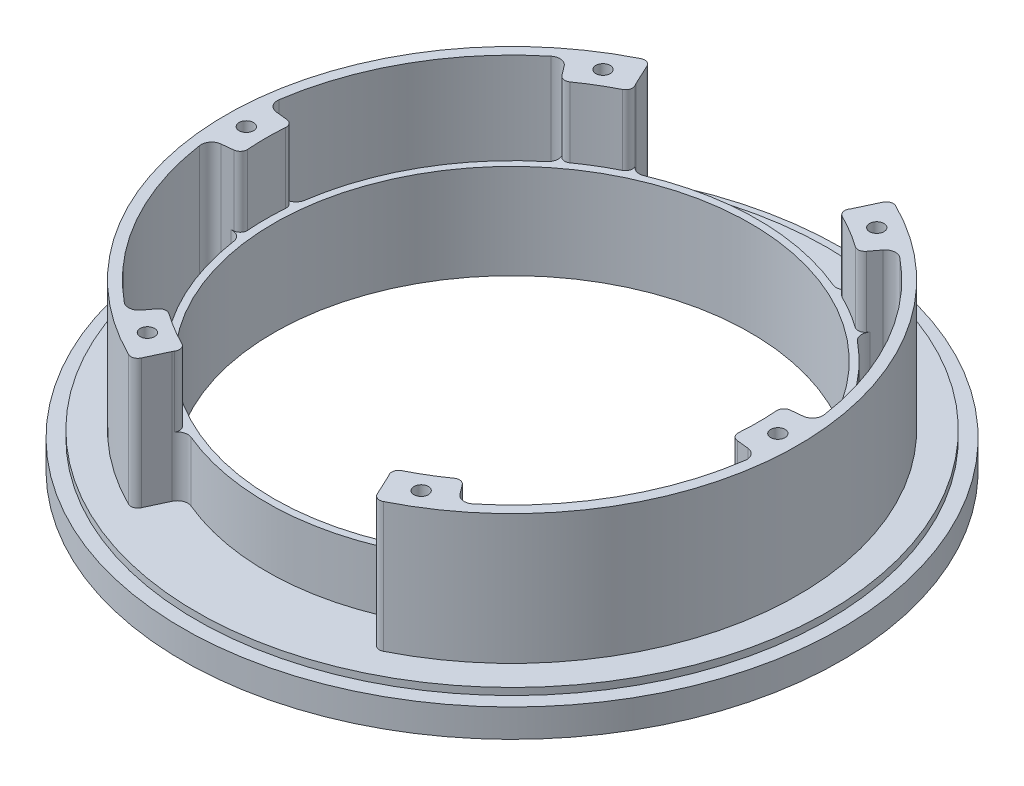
SolidWorks part; units mm, degrees
ref_plane "前视基准面" through (0, 0, 0) normal (0, 0, 1) x (1, 0, 0)
ref_plane "上视基准面" through (0, 0, 0) normal (0, 1, 0) x (1, 0, 0)
ref_plane "右视基准面" through (0, 0, 0) normal (1, 0, 0) x (0, 0, -1)
sketch "草图1" plane through (0, 0, 0) normal (0, 1, 0) x (1, 0, 0)
  circle A0 centre (0, 0) radius 34
  circle A1 centre (0, 0) radius 35
  dimension "D1" = 68
  dimension "D2" = 1
extrude "凸台-拉伸1" add sketch "草图1" along normal blind 23.5
sketch "草图2" plane through (0, 0, 0) normal (0, -1, 0) x (1, 0, 0)
  circle A0 centre (0, 0) radius 45
  circle A1 centre (0, 0) radius 35 construction
  circle A2 centre (0, 0) radius 35
  dimension "D1" = 90
extrude "凸台-拉伸2" add sketch "草图2" against normal blind 5
sketch "草图4" plane through (0, 5, 0) normal (0, 1, 0) x (1, 0, 0)
  circle A0 centre (0, 0) radius 40.8
  circle A1 centre (0, 0) radius 35 construction
  circle A2 centre (0, 0) radius 35
  dimension "D1" = 81.6
extrude "凸台-拉伸3" add sketch "草图4" along normal up to surface (18.5 mm away)
sketch "草图5" plane through (0, 23.5, 0) normal (0, 1, 0) x (1, 0, 0)
  line L0 (0, 59.1249) -> (0, -53.9469) construction
  line L1 (-57.4727, 0) -> (56.5953, 0) construction
  line L2 (0, 0) -> (-17.2428, 36.9774)
  line L3 (0, 0) -> (17.2428, 36.9774)
  line L4 (0, 0) -> (17.2428, -36.9774)
  line L5 (0, 0) -> (-17.2428, -36.9774)
  circle A0 centre (0, 0) radius 40.8 construction
  circle A1 centre (0, 0) radius 40.8 construction
  circle A2 centre (0, 0) radius 40.8
  circle A3 centre (0, 0) radius 35
  circle A4 centre (0, 0) radius 34 construction
  dimension "D2" = 1
  dimension "D1" = 25
extrude "切除-拉伸1" cut sketch "草图5" against normal up to surface (18.5 mm away) contours A3 L3 L2 M6 | A3 L5 L4 M6
sketch "草图6" plane through (0, 0, 0) normal (0, -1, 0) x (1, 0, 0)
  circle A0 centre (0, 0) radius 47
  circle A1 centre (0, 0) radius 45
  circle A2 centre (0, 0) radius 45
  dimension "D2" = 2
  dimension "D1" = 0
extrude "凸台-拉伸4" add sketch "草图6" against normal offset from surface (4 mm away) 1
sketch "草图8" plane through (0, 0, 0) normal (0, -1, 0) x (1, 0, 0)
  circle A0 centre (-10.0813, -37.624) radius 1.5
  circle A1 centre (-5.7574, -38.5233) radius 1.5
  circle A2 centre (-2.3914, -39.0995) radius 1
  circle A3 centre (0.3418, -39.1711) radius 1
  circle A4 centre (3.0734, -39.0518) radius 1
  circle A5 centre (5.7901, -38.7423) radius 1
  circle A6 centre (8.4785, -38.244) radius 1
  circle A7 centre (7.9374, -35.8033) radius 1
  circle A8 centre (5.4205, -36.2697) radius 1
  circle A9 centre (2.8773, -36.5595) radius 1
  circle A10 centre (0.32, -36.6712) radius 1
  circle A11 centre (-2.2388, -36.6042) radius 1
  dimension "D1" = 3
extrude "切除-拉伸3" cut sketch "草图8" against normal through all
sketch "草图9" plane through (0, 23.5, 0) normal (0, 1, 0) x (1, 0, 0)
  circle A0 centre (0, 0) radius 35
extrude "切除-拉伸4" cut sketch "草图9" against normal blind 10
sketch "草图10" plane through (0, 23.5, 0) normal (0, 1, 0) x (1, 0, 0)
  line L0 (0, 0) -> (0, 58.5736) construction
  line L1 (0, 0) -> (-16.0172, 34.3491) construction
  line L2 (-14.7916, 31.7208) -> (-17.2428, 36.9774) construction
  line L3 (-19.5199, 32.4866) -> (0, 0) construction
  line L4 (0, 0) -> (-37.9, 0) construction
  circle A0 centre (0, 0) radius 37.9 construction
  arc A1 (-14.7916, 31.7208) -> (-14.7916, -31.7208) centre (0, 0) ccw construction
  circle A2 centre (-19.5199, 32.4866) radius 1.25
  circle A3 centre (-37.9, 0) radius 1.766
  circle A4 centre (-19.5199, -32.4866) radius 1.25
  circle A5 centre (19.5199, -32.4866) radius 1.25
  circle A6 centre (37.9, 0) radius 1.766
  circle A7 centre (19.5199, 32.4866) radius 1.25
  dimension "D1" = 2.9
  dimension "D2" = 2.5
  dimension "D3" = 6
hole_wizard "M2.5 螺纹孔1" positions "3D草图1" profile "草图12" tap size "M2.5" standard "GB"
sketch3d "3D草图1"
  point P0 (-19.5199, 23.5, -32.4866)
  point P4 (-37.9, 23.5, 0)
  point P7 (19.5199, 23.5, -32.4866)
  point P10 (37.9, 23.5, 0)
  point P13 (19.5199, 23.5, 32.4866)
  point P16 (-19.5199, 23.5, 32.4866)
sketch "草图12" plane through (-19.5199, 23.5, -32.4866) normal (1, 0, 0) x (0, 0, 1)
  line L0 (0, 0) -> (0, 23.5)
  line L1 (0, 23.5) -> (1.025, 23.5)
  line L2 (1.025, 23.5) -> (1.025, 0)
  line L5 (1.025, 0) -> (0, 0)
  line L11 (0, -6.35) -> (0, 107.95) construction
  dimension "通孔螺纹孔钻头直径" = 2.05
  dimension "通孔螺纹孔钻头深度" = 23.5
sketch "草图13" plane through (0, 23.5, 0) normal (0, 1, 0) x (1, 0, 0)
  line L0 (-23.6513, 31.3864) -> (0, 0)
  line L1 (-19.5199, 32.4866) -> (0, 0) construction
  line L2 (0, 0) -> (-56.9776, 0) construction
  line L3 (0, 0) -> (-39.0847, 4.108)
  line L4 (0, 0) -> (-39.0847, -4.108)
  line L5 (-23.6513, -31.3864) -> (0, 0)
  line L6 (0, 0) -> (0, 27.588) construction
  line L7 (23.6513, -31.3864) -> (0, 0)
  line L8 (0, 0) -> (39.0847, -4.108)
  line L9 (0, 0) -> (39.0847, 4.108)
  line L10 (23.6513, 31.3864) -> (0, 0)
  circle A0 centre (0, 0) radius 39.3
  arc A1 (-17.2428, 36.9774) -> (-17.2428, -36.9774) centre (0, 0) ccw construction
  arc A2 (14.7916, -31.7208) -> (14.7916, 31.7208) centre (0, 0) ccw construction
  arc A3 (-14.7916, 31.7208) -> (-14.7916, -31.7208) centre (0, 0) ccw construction
  arc A4 (14.7916, -31.7208) -> (14.7916, 31.7208) centre (0, 0) ccw
  arc A5 (-14.7916, 31.7208) -> (-14.7916, -31.7208) centre (0, 0) ccw
  dimension "D1" = 1.5
  dimension "D2" = 6
  dimension "D3" = 6
extrude "切除-拉伸5" cut sketch "草图13" against normal up to surface (19.5 mm away) contours L0 A0 L3 M12 | L4 A0 L5 M12 | A4 L7 A0 L8 | A4 L9 A0 L10
fillet "圆角1" radius 1.5 16 edges at (21.0635, 8.75, 27.9522) (34.8083, 8.75, 3.6585) (23.6513, 13.75, 31.3864) (39.0847, 13.75, 4.108) (34.8083, 8.75, -3.6585) (21.0635, 8.75, -27.9522) (39.0847, 13.75, -4.108) (23.6513, 13.75, -31.3864) (-34.8083, 8.75, 3.6585) (-21.0635, 8.75, 27.9522) (-23.6513, 13.75, 31.3864) (-39.0847, 13.75, 4.108) (-21.0635, 8.75, -27.9522) (-34.8083, 8.75, -3.6585) (-39.0847, 13.75, -4.108) (-23.6513, 13.75, -31.3864)
sketch "草图14" plane through (0, 23.5, 0) normal (0, 1, 0) x (1, 0, 0)
  circle A0 centre (0, 0) radius 35.1
  arc A1 (-14.7916, 31.7208) -> (-21.0635, 27.9522) centre (0, 0) ccw construction
  dimension "D1" = 0.1
extrude "切除-拉伸6" cut sketch "草图14" against normal up to surface (10 mm away)
fillet "圆角2" radius 1 4 edges at (17.2428, 14.25, 36.9774) (-17.2428, 14.25, 36.9774) (17.2428, 14.25, -36.9774) (-17.2428, 14.25, -36.9774)
fillet "圆角5" radius 1.5 4 edges at (-14.7916, 9.25, 31.7208) (14.7916, 9.25, 31.7208) (-14.7916, 9.25, -31.7208) (14.7916, 9.25, -31.7208)
fillet "圆角6" radius 1 7 edges at (21.1237, 18.5, 28.0321) (34.9077, 18.5, 3.6689) (34.9077, 18.5, -3.6689) (21.1237, 18.5, -28.0321) (13.9999, 18.5, -32.1872) (13.9999, 18.5, 32.1872) (-13.9999, 18.5, 32.1872)
fillet "圆角7" radius 1 1 edges at (-13.9999, 18.5, -32.1872)
fillet "圆角8" radius 1 3 edges at (-34.9077, 18.5, 3.6689) (-34.9077, 18.5, -3.6689) (-21.1237, 18.5, 28.0321)
fillet "圆角9" radius 1 1 edges at (-21.1237, 18.5, -28.0321)
